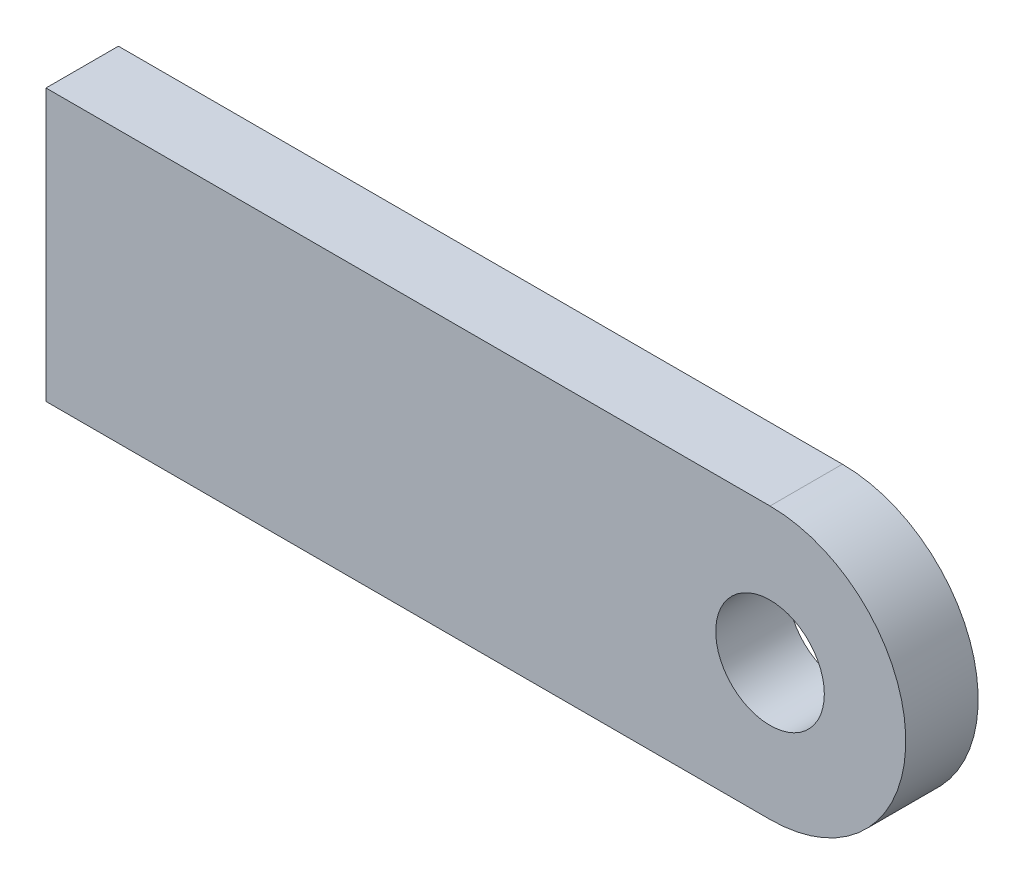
SolidWorks part; units mm, degrees
ref_plane "Front Plane" through (0, 0, 0) normal (0, 0, 1) x (1, 0, 0)
ref_plane "Top Plane" through (0, 0, 0) normal (0, 1, 0) x (1, 0, 0)
ref_plane "Right Plane" through (0, 0, 0) normal (1, 0, 0) x (0, 0, -1)
sketch "Sketch2" plane through (0, 0, 0) normal (0, 0, 1) x (1, 0, 0)
  line L0 (0, 0) -> (50.8, 0)
  line L1 (50.8, -19.05) -> (0, -19.05)
  line L2 (0, -19.05) -> (0, 0)
  arc A0 (50.8, 0) -> (50.8, -19.05) centre (50.8, -9.525) cw
  circle A1 centre (50.8, -9.525) radius 3.81
  dimension "D3" = 7.62
  dimension "D1" = 19.05
  dimension "D2" = 50.8
extrude "Boss-Extrude1" add sketch "Sketch2" along normal mid plane 5.08 contours A0 L0 L2 L1 A1
